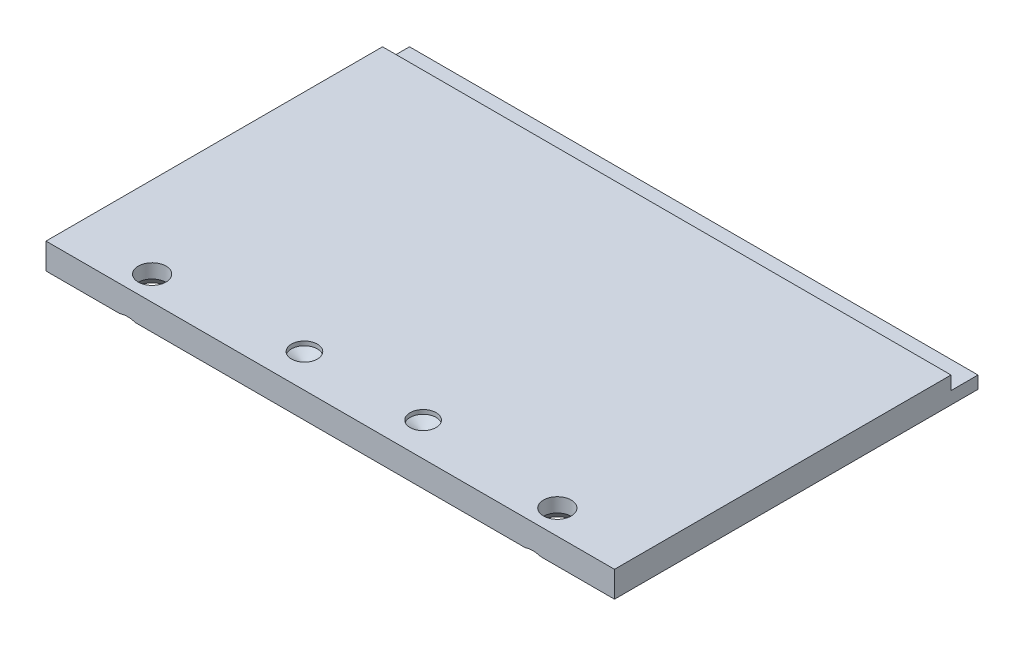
SolidWorks part; units mm, degrees
ref_plane "Front" through (0, 0, 0) normal (0, 0, 1) x (1, 0, 0)
ref_plane "Top" through (0, 0, 0) normal (0, 1, 0) x (1, 0, 0)
ref_plane "Right" through (0, 0, 0) normal (1, 0, 0) x (0, 0, -1)
sketch "Sketch1" plane through (0, 0, 0) normal (0, 1, 0) x (1, 0, 0)
  line L1 (-34.798, 44.5008) -> (34.798, 44.5008)
  line L2 (-34.798, 44.5008) -> (-34.798, 0)
  line L3 (-34.798, 0) -> (34.798, 0)
  line L4 (34.798, 44.5008) -> (34.798, 0)
  point P4 (0, 0)
  dimension "D1" = 69.596
  dimension "D2" = 44.5008
extrude "Extrude1" add sketch "Sketch1" along normal blind 3.175
hole_wizard "CSK for M3 Flat Head Machine Screw1" positions "Sketch3" profile "Sketch2" countersink size "M3" standard "Ansi Metric"
sketch "Sketch3" plane through (0, 0, 0) normal (0, -1, 0) x (1, 0, 0)
  line L0 (-34.798, 0) -> (34.798, 0) construction
  line L1 (34.798, 0) -> (34.798, -44.5008) construction
  line L2 (-34.798, -44.5008) -> (-34.798, 0) construction
  point P0 (24.8031, -2.9972)
  point P1 (-24.8031, -2.9972)
  dimension "D1" = 2.9972
  dimension "D2" = 49.6062
  dimension "D3" = 24.8031
  dimension "D4" = 9.9949
  dimension "D5" = 9.9949
sketch "Sketch2" plane through (24.8031, 0, -2.9972) normal (1, 0, 0) x (0, 0, -1)
  line L0 (0, 0) -> (0, 3.175)
  line L1 (0, 3.175) -> (1.7, 3.175)
  line L2 (1.7, 3.175) -> (1.7, 1.45)
  line L3 (1.7, 1.45) -> (3.15, 0)
  line L5 (3.15, 0) -> (0, 0)
  line L6 (-1.7, 1.45) -> (-3.15, 0) construction
  line L11 (0, -6.35) -> (0, 107.95) construction
  dimension "Thru Hole Dia." = 3.4
  dimension "Thru Hole Depth" = 3.175
  dimension "Near C'Sink Dia." = 6.3
  dimension "Near C'Sink Angle" = 90
sketch "Sketch4" plane through (0, 0, 0) normal (1, 0, 0) x (0, 0, -1)
  line L0 (44.5008, 0) -> (0, 0) construction
  line L1 (50.9773, 1.524) -> (41.1988, 1.524)
  line L2 (50.9773, 1.524) -> (50.9773, 5.0668)
  line L3 (50.9773, 5.0668) -> (41.1988, 5.0668)
  line L4 (41.1988, 1.524) -> (41.1988, 5.0668)
  line L5 (44.5008, 3.175) -> (44.5008, 0) construction
  dimension "D1" = 1.524
  dimension "D2" = 3.302
extrude "Extrude2" cut sketch "Sketch4" against normal through all and the other way through all
sketch "Sketch5" plane through (-0.5212, 0, -26.5062) normal (0, -1, 0) x (-1, 0, 0)
  line L0 (0.6155, -3.5904) -> (0.7246, -3.4431)
  line L1 (-0.4182, -5.2013) -> (-0.5491, -5.3376)
  line L2 (-0.5491, -5.3376) -> (-0.6745, -5.4849)
  line L3 (-0.6745, -5.4849) -> (-0.8272, -5.6703)
  line L4 (-0.8272, -5.6703) -> (-1.0345, -5.8721)
  line L5 (-1.0345, -5.8721) -> (-1.1981, -6.0576)
  line L6 (-1.1981, -6.0576) -> (-1.3836, -6.243)
  line L7 (-1.3836, -6.243) -> (-1.5363, -6.4121)
  line L8 (-1.5363, -6.4121) -> (-1.7163, -6.6303)
  line L9 (-1.7163, -6.6303) -> (-1.8963, -6.843)
  line L10 (-1.8963, -6.843) -> (-2.0872, -7.0666)
  line L11 (-2.0872, -7.0666) -> (-2.2999, -7.2957)
  line L12 (-2.2999, -7.2957) -> (-2.4853, -7.4975)
  line L13 (-2.4853, -7.4975) -> (-2.6544, -7.6775)
  line L14 (-2.6544, -7.6775) -> (-2.8671, -7.8902)
  line L15 (-2.8671, -7.8902) -> (-3.0526, -8.0975)
  line L16 (-3.0526, -8.0975) -> (-3.1617, -8.1957)
  line L17 (-3.1617, -8.1957) -> (-3.0853, -8.2066)
  line L18 (-3.0853, -8.2066) -> (-2.9871, -8.1357)
  line L19 (-2.9871, -8.1357) -> (-2.8617, -8.0048)
  line L20 (-2.8617, -8.0048) -> (-2.7417, -7.8739)
  line L21 (-2.7417, -7.8739) -> (-2.6053, -7.7484)
  line L22 (-2.6053, -7.7484) -> (-2.4635, -7.5957)
  line L23 (-2.4635, -7.5957) -> (-2.3817, -7.5248)
  line L24 (-2.3817, -7.5248) -> (-2.2453, -7.3939)
  line L25 (-2.2453, -7.3939) -> (-2.0708, -7.2248)
  line L26 (-2.0708, -7.2248) -> (-1.9672, -7.1212)
  line L27 (-1.9672, -7.1212) -> (-1.8254, -6.9848)
  line L28 (-1.8254, -6.9848) -> (-1.6617, -6.843)
  line L29 (-1.6617, -6.843) -> (-1.5199, -6.6794)
  line L30 (-1.5199, -6.6794) -> (-1.3563, -6.5266)
  line L31 (-1.3563, -6.5266) -> (-1.2036, -6.3739)
  line L32 (-1.2036, -6.3739) -> (-0.98, -6.1503)
  line L33 (-0.98, -6.1503) -> (-0.8218, -5.9758)
  line L34 (-0.8218, -5.9758) -> (-0.5982, -5.7903)
  line L35 (-0.3062, -5.0848) -> (-0.4182, -5.2013)
  line L36 (0.7519, -0.8687) -> (0.9046, -0.8414)
  line L37 (0.9046, -0.8414) -> (0.9755, -0.8087)
  line L38 (0.9755, -0.8087) -> (1.0901, -0.8033)
  line L39 (1.0901, -0.8033) -> (1.1882, -0.8142)
  line L40 (1.1882, -0.8142) -> (1.2428, -0.9069)
  line L41 (1.2428, -0.9069) -> (1.2701, -1.1087)
  line L42 (1.2701, -1.1087) -> (1.2428, -1.256)
  line L43 (1.2428, -1.256) -> (1.2046, -1.4032)
  line L44 (1.2046, -1.4032) -> (1.1446, -1.5396)
  line L45 (1.1446, -1.5396) -> (1.0682, -1.6923)
  line L46 (1.0682, -1.6923) -> (0.9755, -1.8996)
  line L47 (0.9755, -1.8996) -> (0.8501, -2.025)
  line L48 (0.8501, -2.025) -> (0.7301, -2.1395)
  line L49 (0.7301, -2.1395) -> (0.6264, -2.265)
  line L50 (0.6264, -2.265) -> (0.4901, -2.385)
  line L51 (0.4901, -2.385) -> (0.3101, -2.5432)
  line L52 (0.3101, -2.5432) -> (0.1683, -2.6686)
  line L53 (0.1683, -2.6686) -> (0.0592, -2.7613)
  line L54 (0.0592, -2.7613) -> (-0.0608, -2.865)
  line L55 (-0.0608, -2.865) -> (-0.1862, -2.974)
  line L56 (-0.1862, -2.974) -> (-0.3608, -3.1104)
  line L57 (-0.3608, -3.1104) -> (-0.4917, -3.2577)
  line L58 (-0.4917, -3.2577) -> (-0.628, -3.3668)
  line L59 (-0.628, -3.3668) -> (-0.7698, -3.4758)
  line L60 (-0.7698, -3.4758) -> (-0.9062, -3.6067)
  line L61 (-0.9062, -3.6067) -> (-1.0535, -3.7431)
  line L62 (-1.0535, -3.7431) -> (-1.1789, -3.9231)
  line L63 (-1.1789, -3.9231) -> (-1.2498, -4.0922)
  line L64 (-1.2498, -4.0922) -> (-1.2989, -4.234)
  line L65 (-1.2989, -4.234) -> (-1.3098, -4.3649)
  line L66 (-1.3098, -4.3649) -> (-1.2935, -4.4794)
  line L67 (-1.2935, -4.4794) -> (-1.2553, -4.5612)
  line L68 (-1.2553, -4.5612) -> (-1.2116, -4.6212)
  line L69 (-1.2116, -4.6212) -> (-1.1407, -4.6594)
  line L70 (-1.1407, -4.6594) -> (-1.0971, -4.7085)
  line L71 (-1.0971, -4.7085) -> (-1.168, -4.7358)
  line L72 (-1.168, -4.7358) -> (-1.228, -4.7194)
  line L73 (-1.228, -4.7194) -> (-1.3153, -4.654)
  line L74 (-1.3153, -4.654) -> (-1.408, -4.5612)
  line L75 (-1.408, -4.5612) -> (-1.4898, -4.4522)
  line L76 (-1.4898, -4.4522) -> (-1.5443, -4.3431) construction
  line L77 (-1.5443, -4.3431) -> (-1.5716, -4.2013) construction
  line L78 (-1.5716, -4.2013) -> (-1.5553, -4.1194) construction
  line L79 (-1.5553, -4.1194) -> (-1.528, -3.9667) construction
  line L80 (-1.528, -3.9667) -> (-1.5007, -3.814) construction
  line L81 (-1.5007, -3.814) -> (-1.4571, -3.6667) construction
  line L82 (-1.4571, -3.6667) -> (-1.3971, -3.5249) construction
  line L83 (-1.3971, -3.5249) -> (-1.2771, -3.3504) construction
  line L84 (-1.2771, -3.3504) -> (-1.1298, -3.1977) construction
  line L85 (-1.1298, -3.1977) -> (-1.0807, -3.1104) construction
  line L86 (-1.0807, -3.1104) -> (-0.9226, -2.9577) construction
  line L87 (-0.9226, -2.9577) -> (-0.7698, -2.8268) construction
  line L88 (-0.7698, -2.8268) -> (-0.6389, -2.6904) construction
  line L89 (-0.6389, -2.6904) -> (-0.4699, -2.5377) construction
  line L90 (-0.4699, -2.5377) -> (-0.3062, -2.3523) construction
  line L91 (-0.3062, -2.3523) -> (-0.1153, -2.1995) construction
  line L92 (-0.1153, -2.1995) -> (-0.0335, -2.0686) construction
  line L93 (-0.0335, -2.0686) -> (0.1083, -1.9268) construction
  line L94 (0.1083, -1.9268) -> (0.2556, -1.7796) construction
  line L95 (0.2556, -1.7796) -> (0.3974, -1.6105) construction
  line L96 (0.3974, -1.6105) -> (0.5501, -1.4087) construction
  line L97 (0.5501, -1.4087) -> (0.6755, -1.2287) construction
  line L98 (0.6755, -1.2287) -> (0.7083, -1.0814) construction
  line L99 (0.7083, -1.0814) -> (0.7355, -0.956) construction
  line L100 (0.7355, -0.956) -> (0.7519, -0.8687) construction
  line L101 (0.5337, -1.0814) -> (0.5119, -1.2123)
  line L102 (0.5119, -1.2123) -> (0.4301, -1.3214)
  line L103 (0.4301, -1.3214) -> (0.3646, -1.4305)
  line L104 (0.3646, -1.4305) -> (0.2174, -1.5778)
  line L105 (0.2174, -1.5778) -> (0.0483, -1.7414)
  line L106 (0.0483, -1.7414) -> (-0.0935, -1.8723)
  line L107 (-0.0935, -1.8723) -> (-0.2735, -2.025)
  line L108 (-0.2735, -2.025) -> (-0.388, -2.1614)
  line L109 (-0.388, -2.1614) -> (-0.5299, -2.2923)
  line L110 (-0.5299, -2.2923) -> (-0.688, -2.4395)
  line L111 (-0.688, -2.4395) -> (-0.8026, -2.5486)
  line L112 (-0.8026, -2.5486) -> (-0.8844, -2.6141)
  line L113 (-0.8844, -2.6141) -> (-0.9826, -2.7177)
  line L114 (-0.9826, -2.7177) -> (-1.0589, -2.7995)
  line L115 (-1.0589, -2.7995) -> (-1.1735, -2.9195)
  line L116 (-1.1735, -2.9195) -> (-1.2771, -3.0068)
  line L117 (-1.2771, -3.0068) -> (-1.3589, -3.1213)
  line L118 (-1.3589, -3.1213) -> (-1.4734, -3.2686)
  line L119 (-1.4734, -3.2686) -> (-1.5334, -3.394)
  line L120 (-1.5334, -3.394) -> (-1.5771, -3.5031)
  line L121 (-1.5771, -3.5031) -> (-1.6207, -3.634)
  line L122 (-1.6207, -3.634) -> (-1.6534, -3.7704)
  line L123 (-1.6534, -3.7704) -> (-1.6643, -3.8958)
  line L124 (-1.6643, -3.8958) -> (-1.6698, -4.0049)
  line L125 (-1.6698, -4.0049) -> (-1.6698, -4.1358)
  line L126 (-1.6698, -4.1358) -> (-1.6534, -4.2994)
  line L127 (1.2308, -0.7137) -> (1.1446, -0.6833)
  line L128 (1.1446, -0.6833) -> (1.0519, -0.6833)
  line L129 (1.0519, -0.6833) -> (0.9428, -0.6942)
  line L130 (0.9428, -0.6942) -> (0.801, -0.7378)
  line L131 (0.801, -0.7378) -> (0.6701, -0.8196)
  line L132 (0.6701, -0.8196) -> (0.5337, -0.9123)
  line L133 (0.5337, -0.9123) -> (0.381, -1.016)
  line L134 (0.381, -1.016) -> (0.2283, -1.1305)
  line L135 (0.2283, -1.1305) -> (0.1083, -1.245)
  line L136 (0.1083, -1.245) -> (-0.0608, -1.3869)
  line L137 (-0.0608, -1.3869) -> (-0.1917, -1.5069)
  line L138 (-0.1917, -1.5069) -> (-0.3171, -1.6323)
  line L139 (-0.3171, -1.6323) -> (-0.4262, -1.785)
  line L140 (-0.4262, -1.785) -> (-0.5517, -1.9323)
  line L141 (-0.5517, -1.9323) -> (-0.7208, -2.1014)
  line L142 (-0.7208, -2.1014) -> (-0.8626, -2.2541)
  line L143 (-0.8626, -2.2541) -> (-1.0098, -2.4014)
  line L144 (-1.0098, -2.4014) -> (-1.1789, -2.5704)
  line L145 (-1.1789, -2.5704) -> (-1.3153, -2.6959)
  line L146 (-1.3153, -2.6959) -> (-1.4625, -2.8541)
  line L147 (-1.4625, -2.8541) -> (-1.6043, -2.9959)
  line L148 (-1.6043, -2.9959) -> (-1.7843, -3.1431)
  line L149 (-1.7843, -3.1431) -> (-1.9316, -3.2686)
  line L150 (-1.9316, -3.2686) -> (-2.0461, -3.3613)
  line L151 (-2.0461, -3.3613) -> (-2.2316, -3.454)
  line L152 (-2.2316, -3.454) -> (-2.3625, -3.3722)
  line L153 (-2.3625, -3.3722) -> (-2.4661, -3.2577)
  line L154 (-2.4661, -3.2577) -> (-2.5425, -3.1431)
  line L155 (-2.5425, -3.1431) -> (-2.5916, -3.0122)
  line L156 (-2.5916, -3.0122) -> (-2.6188, -2.8977)
  line L157 (-2.6188, -2.8977) -> (-2.6297, -2.7832)
  line L158 (-2.6297, -2.7832) -> (-2.6516, -2.6413)
  line L159 (-2.6516, -2.6413) -> (-2.6188, -2.565) construction
  line L160 (-2.6188, -2.565) -> (-2.5479, -2.5213) construction
  line L161 (-2.5479, -2.5213) -> (-2.3788, -2.4832) construction
  line L162 (-2.3788, -2.4832) -> (-2.2698, -2.4177) construction
  line L163 (-2.2698, -2.4177) -> (-2.1334, -2.3414) construction
  line L164 (-2.1334, -2.3414) -> (-1.9916, -2.2323) construction
  line L165 (-1.9916, -2.2323) -> (-1.8062, -2.0741) construction
  line L166 (-1.8062, -2.0741) -> (-1.6207, -1.9159) construction
  line L167 (-1.6207, -1.9159) -> (-1.4189, -1.7468) construction
  line L168 (-1.4189, -1.7468) -> (-1.1735, -1.5341) construction
  line L169 (-1.1735, -1.5341) -> (-1.0862, -1.4359) construction
  line L170 (-1.0862, -1.4359) -> (-0.9007, -1.2341) construction
  line L171 (-0.9007, -1.2341) -> (-0.7535, -1.1087) construction
  line L172 (-0.7535, -1.1087) -> (-0.6008, -0.9887) construction
  line L173 (-0.6008, -0.9887) -> (-0.399, -0.8251) construction
  line L174 (-0.399, -0.8251) -> (-0.2244, -0.716) construction
  line L175 (-0.2244, -0.716) -> (-0.0335, -0.6014) construction
  line L176 (-0.0335, -0.6014) -> (0.201, -0.5142) construction
  line L177 (0.201, -0.5142) -> (0.3756, -0.4542) construction
  line L178 (0.3756, -0.4542) -> (0.5665, -0.4105) construction
  line L179 (0.5665, -0.4105) -> (0.741, -0.4051) construction
  line L180 (0.741, -0.4051) -> (0.9319, -0.4105)
  line L181 (0.9319, -0.4105) -> (1.101, -0.4596)
  line L182 (1.101, -0.4596) -> (1.2046, -0.5796)
  line L183 (1.2046, -0.5796) -> (1.2428, -0.6451)
  line L184 (1.2428, -0.6451) -> (1.2379, -0.7091)
  line L185 (0.4737, -0.3396) -> (0.3101, -0.3451)
  line L186 (0.3101, -0.3451) -> (0.081, -0.3887)
  line L187 (0.081, -0.3887) -> (-0.0935, -0.4542)
  line L188 (-0.0935, -0.4542) -> (-0.2462, -0.5305)
  line L189 (-0.2462, -0.5305) -> (-0.4371, -0.6233)
  line L190 (-0.4371, -0.6233) -> (-0.6062, -0.7214)
  line L191 (-0.6062, -0.7214) -> (-0.7644, -0.8414)
  line L192 (-0.7644, -0.8414) -> (-0.9117, -0.9723)
  line L193 (-0.9117, -0.9723) -> (-1.0535, -1.1141)
  line L194 (-1.0535, -1.1141) -> (-1.2062, -1.245)
  line L195 (-1.2062, -1.245) -> (-1.3262, -1.376)
  line L196 (-1.3262, -1.376) -> (-1.4844, -1.5178)
  line L197 (-1.4844, -1.5178) -> (-1.6262, -1.6487)
  line L198 (-1.6262, -1.6487) -> (-1.768, -1.785)
  line L199 (-1.768, -1.785) -> (-1.9316, -1.9268)
  line L200 (-1.9316, -1.9268) -> (-2.117, -2.085)
  line L201 (-2.117, -2.085) -> (-2.2698, -2.1832)
  line L202 (-2.2698, -2.1832) -> (-2.4279, -2.2432)
  line L203 (-2.4279, -2.2432) -> (-2.5534, -2.2814)
  line L204 (-3.4315, -2.6304) -> (-3.5242, -2.3959)
  line L205 (-3.5242, -2.3959) -> (-3.5897, -2.1123)
  line L206 (-3.5897, -2.1123) -> (-3.6279, -1.8832)
  line L207 (-3.6279, -1.8832) -> (-3.6606, -1.6268)
  line L208 (-3.677, -1.1414) -> (-3.6224, -0.9014)
  line L209 (-3.6224, -0.9014) -> (-3.5624, -0.656)
  line L210 (-3.5624, -0.656) -> (-3.4697, -0.3778)
  line L211 (-3.4697, -0.3778) -> (-3.3933, -0.1596)
  line L212 (-2.3407, -3.5304) -> (-2.4279, -3.5795)
  line L213 (-2.4279, -3.5795) -> (-2.5588, -3.5631)
  line L214 (-2.5588, -3.5631) -> (-2.6952, -3.5086)
  line L215 (-2.6952, -3.5086) -> (-2.8534, -3.3886)
  line L216 (-2.8534, -3.3886) -> (-2.9734, -3.274)
  line L217 (-2.9734, -3.274) -> (-3.0661, -3.1759)
  line L218 (-3.0661, -3.1759) -> (-3.197, -3.0068)
  line L219 (-3.197, -3.0068) -> (-3.2461, -2.8431) construction
  line L220 (-3.2461, -2.8431) -> (-3.3061, -2.5813) construction
  line L221 (-3.3061, -2.5813) -> (-3.3606, -2.3523) construction
  line L222 (-3.3606, -2.3523) -> (-3.377, -2.145) construction
  line L223 (-3.377, -2.145) -> (-3.4097, -1.8668) construction
  line L224 (-3.4097, -1.8668) -> (-3.3933, -1.6323) construction
  line L225 (-3.3933, -1.6323) -> (-3.3715, -1.4469) construction
  line L226 (-0.9717, -0.1324) -> (-1.0589, -0.2142)
  line L227 (-1.0589, -0.2142) -> (-1.1571, -0.2796)
  line L228 (-1.1571, -0.2796) -> (-1.2662, -0.3287)
  line L229 (-1.2662, -0.3287) -> (-1.3698, -0.3615)
  line L230 (-1.3698, -0.3615) -> (-1.4953, -0.4269)
  line L231 (-1.4953, -0.4269) -> (-1.6098, -0.4924)
  line L232 (-1.6098, -0.4924) -> (-1.7189, -0.5633)
  line L233 (-1.7189, -0.5633) -> (-1.7789, -0.6833)
  line L234 (-1.7789, -0.6833) -> (-1.8116, -0.8142)
  line L235 (-1.8116, -0.8142) -> (-1.8389, -0.9505)
  line L236 (-1.8389, -0.9505) -> (-1.8607, -1.0814)
  line L237 (-1.8607, -1.0814) -> (-1.8825, -1.2178)
  line L238 (-1.8825, -1.2178) -> (-1.9316, -1.3596)
  line L239 (-1.9316, -1.3596) -> (-2.0134, -1.4959)
  line L240 (-2.0134, -1.4959) -> (-2.117, -1.6214)
  line L241 (-2.117, -1.6214) -> (-2.2425, -1.7196)
  line L242 (-2.2425, -1.7196) -> (-2.3625, -1.8177)
  line L243 (-2.3625, -1.8177) -> (-2.477, -1.8777)
  line L244 (-2.477, -1.8777) -> (-2.5861, -2.0141)
  line L245 (-2.5861, -2.0141) -> (-2.6897, -2.1832)
  line L246 (-2.6897, -2.1832) -> (-2.7497, -2.4177)
  line L247 (-2.7497, -2.4177) -> (-2.7825, -2.6959)
  line L248 (-2.7825, -2.6959) -> (-2.777, -2.8759)
  line L249 (-2.777, -2.8759) -> (-2.7497, -3.0613)
  line L250 (-2.7497, -3.0613) -> (-2.657, -3.2249)
  line L251 (-2.657, -3.2249) -> (-2.5697, -3.3668)
  line L252 (-2.5697, -3.3668) -> (-2.4607, -3.4595)
  line L253 (-2.4607, -3.4595) -> (-2.3407, -3.5304)
  line L254 (-1.0426, -3.994) -> (-0.8844, -3.9667)
  line L255 (-0.8844, -3.9667) -> (-0.7262, -3.8849)
  line L256 (-0.7262, -3.8849) -> (-0.6171, -3.7976)
  line L257 (-0.6171, -3.7976) -> (-0.4535, -3.6449)
  line L258 (-0.4535, -3.6449) -> (-0.2735, -3.4704)
  line L259 (-0.2735, -3.4704) -> (-0.0772, -3.3395)
  line L260 (-0.0772, -3.3395) -> (0.0374, -3.2249)
  line L261 (0.0374, -3.2249) -> (0.2283, -3.1104)
  line L262 (0.2283, -3.1104) -> (0.3592, -3.045)
  line L263 (0.3592, -3.045) -> (0.4901, -3.0068)
  line L264 (0.4901, -3.0068) -> (0.621, -2.9959)
  line L265 (0.621, -2.9959) -> (0.7137, -3.0122)
  line L266 (0.7246, -3.4431) -> (0.8173, -3.4322)
  line L267 (0.8173, -3.4322) -> (0.9101, -3.4431)
  line L268 (0.9101, -3.4431) -> (0.9973, -3.4758)
  line L269 (0.9973, -3.4758) -> (1.0192, -3.5358)
  line L270 (1.0192, -3.5358) -> (1.0082, -3.6995)
  line L271 (1.0082, -3.6995) -> (0.9701, -3.8467)
  line L272 (0.9701, -3.8467) -> (0.8937, -4.0104)
  line L273 (0.8937, -4.0104) -> (0.8283, -4.1849)
  line L274 (0.8283, -4.1849) -> (0.7355, -4.3485)
  line L275 (0.7355, -4.3485) -> (0.621, -4.5122)
  line L276 (0.621, -4.5122) -> (0.4955, -4.6485)
  line L277 (0.4955, -4.6485) -> (0.381, -4.7958)
  line L278 (0.381, -4.7958) -> (0.2774, -4.9049)
  line L279 (0.2774, -4.9049) -> (0.1356, -5.0794)
  line L280 (0.1356, -5.0794) -> (-0.0281, -5.2648)
  line L281 (-0.0281, -5.2648) -> (-0.159, -5.3903)
  line L282 (-0.3062, -5.0848) -> (-0.219, -4.9976)
  line L283 (-0.219, -4.9976) -> (-0.1426, -4.8994)
  line L284 (-0.1426, -4.8994) -> (-0.0553, -4.7521)
  line L285 (-0.0553, -4.7521) -> (0.0374, -4.6158)
  line L286 (0.0374, -4.6158) -> (0.1574, -4.4467)
  line L287 (0.1574, -4.4467) -> (0.261, -4.3049)
  line L288 (0.261, -4.3049) -> (0.4028, -4.0704)
  line L289 (0.4028, -4.0704) -> (0.5065, -3.9122)
  line L290 (0.5065, -3.9122) -> (0.5719, -3.7758)
  line L291 (0.5719, -3.7758) -> (0.5992, -3.6558)
  line L292 (0.5992, -3.6558) -> (0.6155, -3.5904)
  line L293 (0.7246, -3.4431) -> (0.7083, -3.5304) construction
  line L294 (0.7083, -3.5304) -> (0.6974, -3.6395) construction
  line L295 (0.6974, -3.6395) -> (0.681, -3.7649) construction
  line L296 (0.681, -3.7649) -> (0.6155, -3.9449) construction
  line L297 (0.6155, -3.9449) -> (0.5446, -4.114) construction
  line L298 (0.5446, -4.114) -> (0.4737, -4.2667) construction
  line L299 (0.4737, -4.2667) -> (0.3974, -4.4031) construction
  line L300 (0.3974, -4.4031) -> (0.2828, -4.5449) construction
  line L301 (0.2828, -4.5449) -> (0.1465, -4.7031) construction
  line L302 (0.1465, -4.7031) -> (0.0156, -4.8667) construction
  line L303 (0.0156, -4.8667) -> (-0.1317, -5.0303) construction
  line L304 (-0.1317, -5.0303) -> (-0.2026, -5.0848) construction
  line L305 (-0.2026, -5.0848) -> (-0.3062, -5.0848) construction
  line L306 (-1.1189, -4.1358) -> (-1.168, -4.2394)
  line L307 (-1.168, -4.2394) -> (-1.1844, -4.3812)
  line L308 (-1.1844, -4.3812) -> (-1.1407, -4.4631)
  line L309 (-1.1407, -4.4631) -> (-1.0753, -4.5558)
  line L310 (-1.0753, -4.5558) -> (-1.0098, -4.6376)
  line L311 (-1.0098, -4.6376) -> (-0.9117, -4.654)
  line L312 (-0.9117, -4.654) -> (-0.8026, -4.5994)
  line L313 (-0.8026, -4.5994) -> (-0.6662, -4.4958)
  line L314 (-0.6662, -4.4958) -> (-0.5735, -4.4358)
  line L315 (-0.5735, -4.4358) -> (-0.4371, -4.3267)
  line L316 (-0.4371, -4.3267) -> (-0.2844, -4.1958)
  line L317 (-0.2844, -4.1958) -> (-0.1208, -4.0431)
  line L318 (-0.1208, -4.0431) -> (0.0319, -3.9067)
  line L319 (0.0319, -3.9067) -> (0.1519, -3.7704)
  line L320 (0.1519, -3.7704) -> (0.2883, -3.6449)
  line L321 (0.2883, -3.6449) -> (0.4192, -3.5467)
  line L322 (0.4192, -3.5467) -> (0.5555, -3.4322)
  line L323 (0.5555, -3.4322) -> (0.6755, -3.3613)
  line L324 (0.6755, -3.3613) -> (0.7792, -3.3231)
  line L325 (0.7792, -3.3231) -> (0.8828, -3.2904)
  line L326 (0.8828, -3.2904) -> (0.9701, -3.3286)
  line L327 (0.9701, -3.3286) -> (1.0137, -3.334)
  line L328 (1.0137, -3.334) -> (0.9755, -3.2577)
  line L329 (0.9755, -3.2577) -> (0.9319, -3.2031)
  line L330 (0.9319, -3.2031) -> (0.8228, -3.1868) construction
  line L331 (0.8228, -3.1868) -> (0.7301, -3.1377) construction
  line L332 (0.7301, -3.1377) -> (0.5883, -3.1322) construction
  line L333 (0.5883, -3.1322) -> (0.4465, -3.154) construction
  line L334 (0.4465, -3.154) -> (0.3537, -3.1922) construction
  line L335 (0.3537, -3.1922) -> (0.2337, -3.2849) construction
  line L336 (0.2337, -3.2849) -> (0.0974, -3.3668) construction
  line L337 (0.0974, -3.3668) -> (-0.0335, -3.4758) construction
  line L338 (-0.0335, -3.4758) -> (-0.1753, -3.5795) construction
  line L339 (-0.1753, -3.5795) -> (-0.3444, -3.7322) construction
  line L340 (-0.3444, -3.7322) -> (-0.4753, -3.8358) construction
  line L341 (-0.4753, -3.8358) -> (-0.5844, -3.934) construction
  line L342 (-0.5844, -3.934) -> (-0.6935, -4.0267) construction
  line L343 (-0.6935, -4.0267) -> (-0.7753, -4.0758) construction
  line L344 (-0.7753, -4.0758) -> (-0.9007, -4.1358) construction
  line L345 (-0.9007, -4.1358) -> (-0.9989, -4.1576) construction
  line L346 (-0.9989, -4.1576) -> (-1.1189, -4.1358) construction
  line L347 (2.4318, 3.2329) -> (2.41, 3.2656)
  line L348 (2.41, 3.2656) -> (2.35, 3.2874)
  line L349 (2.35, 3.2874) -> (2.2791, 3.2984)
  line L350 (2.2791, 3.2984) -> (2.2136, 3.2984)
  line L351 (2.2136, 3.2984) -> (2.1427, 3.2984)
  line L352 (2.1427, 3.2984) -> (2.0773, 3.2874)
  line L353 (2.0773, 3.2874) -> (2.0173, 3.2874)
  line L354 (2.0173, 3.2874) -> (1.9518, 3.2984)
  line L355 (1.9518, 3.2984) -> (1.8864, 3.3202)
  line L356 (1.8864, 3.3202) -> (1.8046, 3.3147)
  line L357 (1.8046, 3.3147) -> (1.7009, 3.3038)
  line L358 (1.7009, 3.3038) -> (1.6355, 3.2929)
  line L359 (1.6355, 3.2929) -> (1.5373, 3.2765)
  line L360 (1.5373, 3.2765) -> (1.461, 3.2602)
  line L361 (1.461, 3.2602) -> (1.4064, 3.2547)
  line L362 (1.4064, 3.2547) -> (1.3246, 3.2274)
  line L363 (1.3246, 3.2274) -> (1.2537, 3.2056)
  line L364 (1.2537, 3.2056) -> (1.1937, 3.1784)
  line L365 (1.1937, 3.1784) -> (1.1064, 3.1511)
  line L366 (1.1064, 3.1511) -> (1.0355, 3.1184)
  line L367 (1.0355, 3.1184) -> (0.9646, 3.0856)
  line L368 (0.9646, 3.0856) -> (0.8992, 3.0584)
  line L369 (0.8992, 3.0584) -> (0.8119, 3.0093)
  line L370 (0.8119, 3.0093) -> (0.741, 2.9711)
  line L371 (0.741, 2.9711) -> (0.6374, 2.9056)
  line L372 (0.6374, 2.9056) -> (0.5337, 2.8566)
  line L373 (0.5337, 2.8566) -> (0.4301, 2.802)
  line L374 (0.4301, 2.802) -> (0.3756, 2.7638)
  line L375 (0.3756, 2.7638) -> (0.3101, 2.7311)
  line L376 (0.3101, 2.7311) -> (0.2228, 2.6711)
  line L377 (0.2228, 2.6711) -> (0.141, 2.622)
  line L378 (0.141, 2.622) -> (0.0319, 2.5457)
  line L379 (0.0319, 2.5457) -> (-0.0499, 2.4857)
  line L380 (-0.0499, 2.4857) -> (-0.1426, 2.4257)
  line L381 (-0.1426, 2.4257) -> (-0.2408, 2.3602)
  line L382 (-0.2408, 2.3602) -> (-0.3117, 2.3057)
  line L383 (-0.3117, 2.3057) -> (-0.388, 2.262)
  line L384 (-0.388, 2.262) -> (-0.4862, 2.1911)
  line L385 (-0.4862, 2.1911) -> (-0.5571, 2.1475)
  line L386 (-0.5571, 2.1475) -> (-0.6226, 2.0875)
  line L387 (-0.6226, 2.0875) -> (-0.7208, 2.0166)
  line L388 (-0.7208, 2.0166) -> (-0.7917, 1.9566)
  line L389 (-0.7917, 1.9566) -> (-0.8735, 1.8966)
  line L390 (-0.8735, 1.8966) -> (-0.9717, 1.8202)
  line L391 (-0.9717, 1.8202) -> (-1.0589, 1.7548)
  line L392 (-1.0589, 1.7548) -> (-1.1898, 1.6403) construction
  line L393 (-1.1898, 1.6403) -> (-1.2716, 1.5857) construction
  line L394 (-1.2716, 1.5857) -> (-1.3589, 1.5203) construction
  line L395 (-1.3589, 1.5203) -> (-1.4734, 1.4221) construction
  line L396 (-1.4734, 1.4221) -> (-1.5771, 1.2966) construction
  line L397 (-1.5771, 1.2966) -> (-1.6807, 1.2203) construction
  line L398 (-1.6807, 1.2203) -> (-1.7625, 1.1439) construction
  line L399 (-1.7625, 1.1439) -> (-1.8607, 1.0676) construction
  line L400 (-1.8607, 1.0676) -> (-1.948, 0.9803) construction
  line L401 (-1.948, 0.9803) -> (-2.0243, 0.9148) construction
  line L402 (-2.0243, 0.9148) -> (-2.0789, 0.8548) construction
  line L403 (-2.0789, 0.8548) -> (-2.1607, 0.7676) construction
  line L404 (-2.1607, 0.7676) -> (-2.237, 0.6749) construction
  line L405 (-2.237, 0.6749) -> (-2.2916, 0.6258) construction
  line L406 (-2.2916, 0.6258) -> (-2.3461, 0.5385) construction
  line L407 (-2.3461, 0.5385) -> (-2.417, 0.473) construction
  line L408 (-2.417, 0.473) -> (-2.4661, 0.4076) construction
  line L409 (-2.4661, 0.4076) -> (-2.5316, 0.3421) construction
  line L410 (-2.5316, 0.3421) -> (-2.5861, 0.2494) construction
  line L411 (-2.5861, 0.2494) -> (-2.6407, 0.1676) construction
  line L412 (-2.6407, 0.1676) -> (-2.7279, 0.0585) construction
  line L413 (-2.7279, 0.0585) -> (-2.777, -0.0342) construction
  line L414 (-2.777, -0.0342) -> (-2.837, -0.1269) construction
  line L415 (-2.837, -0.1269) -> (-2.8861, -0.2251) construction
  line L416 (-2.8861, -0.2251) -> (-2.9352, -0.3178) construction
  line L417 (-2.9352, -0.3178) -> (-2.9788, -0.416) construction
  line L418 (-2.9788, -0.416) -> (-3.011, -0.4836) construction
  line L419 (-1.2389, 1.7821) -> (-1.1407, 1.7758)
  line L420 (-0.9717, -0.1324) -> (-0.9062, -0.0724)
  line L421 (-0.9062, -0.0724) -> (-0.8626, 0.004)
  line L422 (-0.8626, 0.004) -> (-0.8189, 0.0803)
  line L423 (-0.8189, 0.0803) -> (-0.7971, 0.1676)
  line L424 (-0.7971, 0.1676) -> (-0.7917, 0.244)
  line L425 (-0.7917, 0.244) -> (-0.7644, 0.3203)
  line L426 (-0.7644, 0.3203) -> (-0.7589, 0.4021)
  line L427 (-0.7589, 0.4021) -> (-0.7371, 0.4785)
  line L428 (-0.7371, 0.4785) -> (-0.7208, 0.5821)
  line L429 (-0.7208, 0.5821) -> (-0.6771, 0.6585)
  line L430 (-0.6771, 0.6585) -> (-0.6062, 0.7294)
  line L431 (-0.6062, 0.7294) -> (-0.5408, 0.7785)
  line L432 (-0.5408, 0.7785) -> (-0.5244, 0.8712)
  line L433 (-0.5244, 0.8712) -> (-0.5299, 0.9312)
  line L434 (-0.5299, 0.9312) -> (-0.5571, 1.013)
  line L435 (-0.5571, 1.013) -> (-0.5626, 1.0785)
  line L436 (-0.5626, 1.0785) -> (-0.568, 1.1494)
  line L437 (-0.568, 1.1494) -> (-0.5626, 1.2094)
  line L438 (-0.5626, 1.2094) -> (-0.5571, 1.2857)
  line L439 (-0.5571, 1.2857) -> (-0.5353, 1.3512)
  line L440 (-0.5353, 1.3512) -> (-0.5189, 1.4166)
  line L441 (-0.5189, 1.4166) -> (-0.5026, 1.4657)
  line L442 (-0.5026, 1.4657) -> (-0.5026, 1.4821)
  line L443 (-0.4923, 1.4838) -> (-0.4699, 1.4166)
  line L444 (-0.4699, 1.4166) -> (-0.4808, 1.3512)
  line L445 (-0.4808, 1.3512) -> (-0.4753, 1.2585)
  line L446 (-0.4753, 1.2585) -> (-0.4753, 1.1876)
  line L447 (-0.4753, 1.1876) -> (-0.4753, 1.1057)
  line L448 (-0.4753, 1.1057) -> (-0.448, 1.0294)
  line L449 (-0.448, 1.0294) -> (-0.4371, 0.9857)
  line L450 (-0.4371, 0.9857) -> (-0.4143, 0.9538)
  line L451 (-0.4056, 0.954) -> (-0.3553, 1.0294)
  line L452 (-0.3553, 1.0294) -> (-0.328, 1.1003)
  line L453 (-0.328, 1.1003) -> (-0.279, 1.1876)
  line L454 (-0.279, 1.1876) -> (-0.2462, 1.2585)
  line L455 (-0.2462, 1.2585) -> (-0.2135, 1.3185)
  line L456 (-0.2135, 1.3185) -> (-0.1753, 1.3839)
  line L457 (-0.1753, 1.3839) -> (-0.1317, 1.4494)
  line L458 (-0.1317, 1.4494) -> (-0.097, 1.5089)
  line L459 (-0.0887, 1.5099) -> (-0.0608, 1.4821)
  line L460 (-0.0608, 1.4821) -> (-0.0772, 1.4057)
  line L461 (-0.0772, 1.4057) -> (-0.099, 1.313)
  line L462 (-0.099, 1.313) -> (-0.1262, 1.2039)
  line L463 (-0.1262, 1.2039) -> (-0.159, 1.0948)
  line L464 (-0.159, 1.0948) -> (-0.1917, 0.9803)
  line L465 (-0.1917, 0.9803) -> (-0.2353, 0.893)
  line L466 (-0.2353, 0.893) -> (-0.2735, 0.8003)
  line L467 (-0.2735, 0.8003) -> (-0.3117, 0.7294)
  line L468 (-0.3117, 0.7294) -> (-0.3161, 0.6894)
  line L469 (-0.3087, 0.684) -> (-0.2299, 0.7185)
  line L470 (-0.2299, 0.7185) -> (-0.1644, 0.7894)
  line L471 (-0.1644, 0.7894) -> (-0.0826, 0.8658)
  line L472 (-0.0826, 0.8658) -> (0.0047, 0.9367)
  line L473 (0.0047, 0.9367) -> (0.141, 1.0457)
  line L474 (0.141, 1.0457) -> (0.2283, 1.1385)
  line L475 (0.2283, 1.1385) -> (0.3919, 1.2585)
  line L476 (0.3919, 1.2585) -> (0.5174, 1.3621)
  line L477 (0.5174, 1.3621) -> (0.6155, 1.4439)
  line L478 (0.6155, 1.4439) -> (0.681, 1.5148)
  line L479 (0.681, 1.5148) -> (0.8664, 1.6512)
  line L480 (0.8664, 1.6512) -> (0.9592, 1.7221)
  line L481 (0.9592, 1.7221) -> (1.0573, 1.8093)
  line L482 (1.0573, 1.8093) -> (1.1391, 1.8748)
  line L483 (1.1391, 1.8748) -> (1.2264, 1.9348)
  line L484 (1.2264, 1.9348) -> (1.3137, 2.0057)
  line L485 (1.3137, 2.0057) -> (1.4119, 2.093)
  line L486 (1.4119, 2.093) -> (1.51, 2.1966)
  line L487 (1.51, 2.1966) -> (1.5973, 2.2948)
  line L488 (1.5973, 2.2948) -> (1.6573, 2.4039)
  line L489 (1.6573, 2.4039) -> (1.7173, 2.5129)
  line L490 (1.7173, 2.5129) -> (1.7937, 2.6002)
  line L491 (1.7937, 2.6002) -> (1.8427, 2.7202)
  line L492 (1.8427, 2.7202) -> (1.9137, 2.8075)
  line L493 (1.9137, 2.8075) -> (1.9791, 2.8893)
  line L494 (1.9791, 2.8893) -> (2.0282, 2.9493)
  line L495 (2.0282, 2.9493) -> (2.0827, 3.0256)
  line L496 (2.0827, 3.0256) -> (2.1318, 3.0638)
  line L497 (2.1318, 3.0638) -> (2.1918, 3.102)
  line L498 (2.1918, 3.102) -> (2.1973, 3.0529)
  line L499 (2.1973, 3.0529) -> (2.1318, 2.9656)
  line L500 (2.1318, 2.9656) -> (2.0718, 2.8566)
  line L501 (2.0718, 2.8566) -> (2.0064, 2.7747)
  line L502 (2.0064, 2.7747) -> (1.9627, 2.6875)
  line L503 (1.9627, 2.6875) -> (1.8918, 2.562)
  line L504 (1.8918, 2.562) -> (1.8646, 2.4911)
  line L505 (1.8646, 2.4911) -> (1.8209, 2.4148)
  line L506 (1.8209, 2.4148) -> (1.7937, 2.322)
  line L507 (1.7937, 2.322) -> (1.7718, 2.2293)
  line L508 (1.7718, 2.2293) -> (1.7337, 2.1202)
  line L509 (1.7337, 2.1202) -> (1.6791, 1.9893)
  line L510 (1.6791, 1.9893) -> (1.6082, 1.8912)
  line L511 (1.6082, 1.8912) -> (1.5264, 1.793)
  line L512 (1.5264, 1.793) -> (1.4282, 1.6893)
  line L513 (1.4282, 1.6893) -> (1.33, 1.5966)
  line L514 (1.33, 1.5966) -> (1.2319, 1.5203)
  line L515 (1.2319, 1.5203) -> (1.1173, 1.4221)
  line L516 (1.1173, 1.4221) -> (1.0028, 1.3294)
  line L517 (1.0028, 1.3294) -> (0.9155, 1.2421)
  line L518 (0.9155, 1.2421) -> (0.8283, 1.1766)
  line L519 (0.8283, 1.1766) -> (0.7301, 1.0621)
  line L520 (0.7301, 1.0621) -> (0.8283, 1.073)
  line L521 (0.8283, 1.073) -> (0.9046, 1.1276)
  line L522 (0.9046, 1.1276) -> (0.9973, 1.2094)
  line L523 (0.9973, 1.2094) -> (1.101, 1.2912)
  line L524 (1.101, 1.2912) -> (1.2373, 1.4166)
  line L525 (1.2373, 1.4166) -> (1.3519, 1.5094)
  line L526 (1.3519, 1.5094) -> (1.4991, 1.6403)
  line L527 (1.4991, 1.6403) -> (1.63, 1.7875)
  line L528 (1.63, 1.7875) -> (1.7446, 1.9293)
  line L529 (1.7446, 1.9293) -> (1.87, 2.1039)
  line L530 (1.87, 2.1039) -> (1.8864, 2.2184)
  line L531 (1.8864, 2.2184) -> (1.9355, 2.3711)
  line L532 (1.9355, 2.3711) -> (1.9846, 2.5075)
  line L533 (1.9846, 2.5075) -> (2.0227, 2.6329)
  line L534 (2.0227, 2.6329) -> (2.0827, 2.7802)
  line L535 (2.0827, 2.7802) -> (2.1973, 2.8947)
  line L536 (2.1973, 2.8947) -> (2.2627, 3.0038)
  line L537 (2.2627, 3.0038) -> (2.3009, 3.1129)
  line L538 (2.3009, 3.1129) -> (2.3555, 3.1456)
  line L539 (2.3555, 3.1456) -> (2.3936, 3.1675)
  line L540 (2.3936, 3.1675) -> (2.4318, 3.2329)
  line L541 (-1.2389, 1.7821) -> (-1.3589, 1.7657)
  line L542 (-1.3589, 1.7657) -> (-1.4298, 1.7493)
  line L543 (-1.4298, 1.7493) -> (-1.5389, 1.7221)
  line L544 (-1.5389, 1.7221) -> (-1.648, 1.6839)
  line L545 (-1.648, 1.6839) -> (-1.768, 1.6512)
  line L546 (-1.768, 1.6512) -> (-1.8989, 1.5748)
  line L547 (-1.8989, 1.5748) -> (-2.057, 1.4603)
  line L548 (-2.057, 1.4603) -> (-2.177, 1.3566)
  line L549 (-2.177, 1.3566) -> (-2.3079, 1.253)
  line L550 (-2.3079, 1.253) -> (-2.4279, 1.1548)
  line L551 (-2.4279, 1.1548) -> (-2.5261, 1.0403)
  line L552 (-2.5261, 1.0403) -> (-2.6243, 0.9312)
  line L553 (-2.6243, 0.9312) -> (-2.7388, 0.7894)
  line L554 (-2.7388, 0.7894) -> (-2.8261, 0.6858)
  line L555 (-2.8261, 0.6858) -> (-2.9243, 0.5767)
  line L556 (2.6991, 0.8767) -> (2.6336, 0.9148)
  line L557 (2.6336, 0.9148) -> (2.59, 0.8439)
  line L558 (2.59, 0.8439) -> (2.5245, 0.8058)
  line L559 (2.5245, 0.8058) -> (2.4536, 0.8003)
  line L560 (2.4536, 0.8003) -> (2.3936, 0.7785)
  line L561 (2.3936, 0.7785) -> (2.3227, 0.8658)
  line L562 (2.3227, 0.8658) -> (2.2845, 0.773)
  line L563 (2.2845, 0.773) -> (2.1536, 0.7512)
  line L564 (2.1536, 0.7512) -> (2.0555, 0.7512)
  line L565 (2.0555, 0.7512) -> (2.0009, 0.7512)
  line L566 (2.0009, 0.7512) -> (1.9573, 0.8658)
  line L567 (1.9573, 0.8658) -> (1.9082, 0.7621)
  line L568 (1.9082, 0.7621) -> (1.8264, 0.7512)
  line L569 (1.8264, 0.7512) -> (1.7337, 0.7512)
  line L570 (1.7337, 0.7512) -> (1.6246, 0.7567)
  line L571 (1.6246, 0.7567) -> (1.57, 0.7567)
  line L572 (1.57, 0.7567) -> (1.5319, 0.8548)
  line L573 (1.5319, 0.8548) -> (1.4828, 0.7839)
  line L574 (1.4828, 0.7839) -> (1.401, 0.7948)
  line L575 (1.401, 0.7948) -> (1.2919, 0.8003)
  line L576 (1.2919, 0.8003) -> (1.1773, 0.7839)
  line L577 (1.1773, 0.7839) -> (1.1664, 0.8767)
  line L578 (1.1664, 0.8767) -> (1.1173, 0.8221)
  line L579 (1.1173, 0.8221) -> (1.0301, 0.8167)
  line L580 (1.0301, 0.8167) -> (0.921, 0.8385)
  line L581 (0.921, 0.8385) -> (0.861, 0.8494)
  line L582 (0.861, 0.8494) -> (0.8064, 0.9421)
  line L583 (0.8064, 0.9421) -> (0.7464, 0.8985)
  line L584 (0.7464, 0.8985) -> (0.6537, 0.9148)
  line L585 (0.6537, 0.9148) -> (0.5446, 0.9421)
  line L586 (0.5446, 0.9421) -> (0.4301, 0.9803)
  line L587 (0.4301, 0.9803) -> (0.3592, 1.0076)
  line L588 (0.3592, 1.0076) -> (0.261, 0.9367)
  line L589 (0.261, 0.9367) -> (0.1956, 0.8821)
  line L590 (0.1956, 0.8821) -> (0.1301, 0.8276)
  line L591 (0.1301, 0.8276) -> (0.0647, 0.773)
  line L592 (0.0647, 0.773) -> (-0.0117, 0.713)
  line L593 (-0.0117, 0.713) -> (-0.0935, 0.6803)
  line L594 (-0.0935, 0.6803) -> (-0.1575, 0.6508)
  line L595 (-0.159, 0.6422) -> (-0.099, 0.5821)
  line L596 (-0.099, 0.5821) -> (-0.0117, 0.5712)
  line L597 (-0.0117, 0.5712) -> (0.1465, 0.5494)
  line L598 (0.1465, 0.5494) -> (0.3046, 0.5221)
  line L599 (0.3046, 0.5221) -> (0.5392, 0.484)
  line L600 (0.5392, 0.484) -> (0.8173, 0.4621)
  line L601 (0.8173, 0.4621) -> (1.0628, 0.4403)
  line L602 (1.0628, 0.4403) -> (1.2701, 0.4349)
  line L603 (1.2701, 0.4349) -> (1.4555, 0.4458)
  line L604 (1.4555, 0.4458) -> (1.5341, 0.4458)
  line L605 (1.5367, 0.4359) -> (1.4228, 0.3694)
  line L606 (1.4228, 0.3694) -> (1.2973, 0.3476)
  line L607 (1.2973, 0.3476) -> (1.1446, 0.3203)
  line L608 (1.1446, 0.3203) -> (1.0082, 0.2985)
  line L609 (1.0082, 0.2985) -> (0.8173, 0.304)
  line L610 (0.8173, 0.304) -> (0.7301, 0.304)
  line L611 (0.5883, 0.304) -> (0.526, 0.3086)
  line L612 (0.441, 0.3149) -> (0.3156, 0.3258)
  line L613 (0.3156, 0.3258) -> (0.1683, 0.3421)
  line L614 (0.0156, 0.3967) -> (-0.0717, 0.4512)
  line L615 (-0.0717, 0.4512) -> (-0.1765, 0.4655)
  line L616 (0.0156, 0.3967) -> (0.1683, 0.3421)
  line L617 (0.526, 0.3086) -> (0.441, 0.3149)
  line L618 (0.7301, 0.304) -> (0.5883, 0.304)
  line L619 (1.75, 0.3476) -> (1.8864, 0.3858)
  line L620 (1.8864, 0.3858) -> (2.0664, 0.424)
  line L621 (2.0664, 0.424) -> (2.2082, 0.4894)
  line L622 (2.2082, 0.4894) -> (2.4045, 0.5658)
  line L623 (2.4045, 0.5658) -> (2.5082, 0.6258)
  line L624 (2.5082, 0.6258) -> (2.6118, 0.6967)
  line L625 (2.6118, 0.6967) -> (2.6936, 0.7785)
  line L626 (2.6936, 0.7785) -> (2.7372, 0.8221)
  line L627 (-1.1407, 1.7758) -> (-1.0589, 1.7548)
  line L628 (1.4228, 0.2623) -> (1.2973, 0.2405)
  line L629 (1.2973, 0.2405) -> (1.1446, 0.2132)
  line L630 (1.1446, 0.2132) -> (1.0082, 0.1914)
  line L631 (1.0082, 0.1914) -> (0.8173, 0.1969)
  line L632 (0.8173, 0.1969) -> (0.7301, 0.1969)
  line L633 (0.526, 0.2015) -> (0.7301, 0.1969)
  line L634 (0.526, 0.2015) -> (0.441, 0.2078)
  line L635 (0.3156, 0.2187) -> (0.1683, 0.2351)
  line L636 (0.441, 0.2078) -> (0.3156, 0.2187)
  line L637 (0.0156, 0.2896) -> (0.1683, 0.2351)
  line L638 (0.0156, 0.2896) -> (-0.0717, 0.3441)
  line L639 (-0.0717, 0.3441) -> (-0.181, 0.4566)
  line L640 (8.3517, -0.7329) -> (10.2369, 1.1523)
  line L641 (7.8185, -0.7329) -> (8.3517, -0.7329)
  line L642 (4.048, -4.5034) -> (7.8185, -0.7329)
  line L643 (3.5148, -4.5034) -> (4.048, -4.5034)
  line L644 (-0.2557, -8.2738) -> (3.5148, -4.5034)
  line L645 (8.1955, -0.3559) -> (9.7037, 1.1523)
  line L646 (7.6623, -0.3559) -> (8.1955, -0.3559)
  line L647 (7.2852, -0.7329) -> (7.6623, -0.3559)
  line L648 (3.8918, -4.1263) -> (7.2852, -0.7329)
  line L649 (3.3586, -4.1263) -> (3.8918, -4.1263)
  line L650 (-0.2557, -7.7406) -> (3.3586, -4.1263)
  line L651 (-6.3418, -2.2952) -> (-9.7771, 1.0559)
  line L652 (-5.8086, -2.2886) -> (-6.3418, -2.2952)
  line L653 (-0.2557, -7.7406) -> (-1.2733, -6.723)
  line L654 (-6.4446, -2.6181) -> (-10.215, 1.1523)
  line L655 (-5.9114, -2.6181) -> (-6.4446, -2.6181)
  line L656 (-0.2557, -8.2738) -> (-1.4826, -7.0469)
  line L657 (0.7137, -3.0122) -> (0.8283, -3.1213)
  line L658 (-1.7476, -6.2501) -> (-1.9563, -6.5732)
  line L659 (-1.7476, -6.2501) -> (-5.8086, -2.2886)
  line L660 (-1.9563, -6.5732) -> (-5.9114, -2.6181)
  line L661 (-1.2733, -6.723) -> (-1.4826, -7.0469)
  line L662 (0.8283, -3.1213) -> (0.9319, -3.2031)
  line L663 (-1.1189, -4.1358) -> (-1.0426, -3.994)
  line L664 (0.5337, -1.0814) -> (0.6537, -0.956)
  line L665 (-1.6534, -4.2994) -> (-1.5716, -4.4211)
  line L666 (-1.4898, -4.4522) -> (-1.5716, -4.4211)
  line L667 (0.6537, -0.956) -> (0.7519, -0.8687)
  line L668 (0.741, -0.4051) -> (0.4737, -0.3396)
  line L669 (-2.5534, -2.2814) -> (-2.6188, -2.3414)
  line L670 (-2.6188, -2.3414) -> (-2.6516, -2.4605)
  line L671 (-2.6516, -2.4605) -> (-2.6516, -2.6413)
  line L672 (-3.197, -3.0068) -> (-3.4315, -2.6304)
  line L673 (2.6991, 0.8767) -> (2.7318, 0.8576)
  line L674 (2.7318, 0.8576) -> (2.7372, 0.8221)
  arc A0 (-3.011, -0.4836) -> (-3.3715, -1.4469) centre (1.0587, -2.5558) ccw construction
  arc A1 (-2.9243, 0.5767) -> (-3.3933, -0.1596) centre (-0.5823, -1.4328) ccw
  arc A2 (-3.677, -1.1414) -> (-3.6606, -1.6268) centre (-1.8553, -1.323) ccw
  arc A3 (-0.5982, -5.7903) -> (-0.159, -5.3903) centre (-9.3106, 4.216) ccw
  arc A4 (1.75, 0.3476) -> (1.4228, 0.2623) centre (15.5216, -53.1803) ccw
  arc A5 (13.4742, 3.0376) -> (10.2369, 1.1523) centre (15.3552, -3.9146) ccw
  arc A6 (13.4742, 3.0376) -> (9.7037, 1.1523) centre (14.379, -3.4852) ccw
  arc A7 (-9.7771, 1.0559) -> (-13.4523, 3.0376) centre (-14.5788, -3.4506) ccw
  arc A8 (-10.215, 1.1523) -> (-13.4523, 3.0376) centre (-15.3333, -3.9146) ccw
  circle A9 centre (1.8046, 3.0311) radius 0.06
  arc A10 (-0.4923, 1.4838) -> (-0.5026, 1.4821) centre (-0.4973, 1.4821) ccw
  arc A11 (-0.0887, 1.5099) -> (-0.097, 1.5089) centre (-0.0924, 1.5062) ccw
  arc A12 (1.5367, 0.4359) -> (1.5341, 0.4458) centre (1.5341, 0.4405) ccw
  arc A13 (-0.1575, 0.6508) -> (-0.159, 0.6422) centre (-0.1553, 0.646) ccw
  arc A14 (-0.3161, 0.6894) -> (-0.3087, 0.684) centre (-0.3109, 0.6888) ccw
  arc A15 (-0.4143, 0.9538) -> (-0.4056, 0.954) centre (-0.41, 0.9569) ccw
  arc A16 (-0.1765, 0.4655) -> (-0.181, 0.4566) centre (-0.1772, 0.4603) ccw
  arc A17 (1.2308, -0.7137) -> (1.2379, -0.7091) centre (1.2326, -0.7087) ccw
extrude "EEL Logo" cut sketch "Sketch5" against normal blind 0.254
sketch "Sketch6" plane through (0, 0, 0) normal (0, -1, 0) x (1, 0, 0)
  line L0 (30.8292, -17.4625) -> (-30.0355, -17.4625) construction
  line L1 (-23.8339, 0) -> (23.8339, 0) construction
  line L2 (34.798, 0) -> (34.798, -44.5008) construction
  line L3 (-34.798, -44.5008) -> (-34.798, 0) construction
  text T0 "MBARI             ISUS" font "Century Gothic" height in points 18
  dimension "D1" = 17.4625
  dimension "D2" = 3.9688
  dimension "D3" = 4.7625
extrude "Extrude3" cut sketch "Sketch6" against normal blind 0.254
hole_wizard "1/8 (0.125) Diameter Hole1" positions "Sketch8" profile "Sketch7" hole size "1/8" standard "Ansi Inch"
sketch "Sketch8" plane through (0, 3.175, 0) normal (0, 1, 0) x (-1, 0, 0)
  line L0 (34.798, 0) -> (-34.798, 0) construction
  point P0 (7.2644, -4.1021)
  point P9 (-7.2644, -4.1021)
  point P13 (0, 0)
  dimension "D1" = 4.1021
  dimension "D2" = 7.2644
  dimension "D3" = 7.2644
sketch "Sketch7" plane through (-7.2644, 3.175, -4.1021) normal (1, 0, 0) x (0, 0, 1)
  line L0 (0, 0) -> (0, 1.4619)
  line L1 (0, 1.4619) -> (1.5875, 0.508)
  line L2 (1.5875, 0.508) -> (1.5875, 0)
  line L5 (1.5875, 0) -> (0, 0)
  line L10 (0, 1.4619) -> (-1.5875, 0.508) construction
  line L11 (0, -6.35) -> (0, 107.95) construction
  dimension "Hole Dia." = 3.175
  dimension "Hole Depth" = 0.508
  dimension "Drill Angle" = 118
